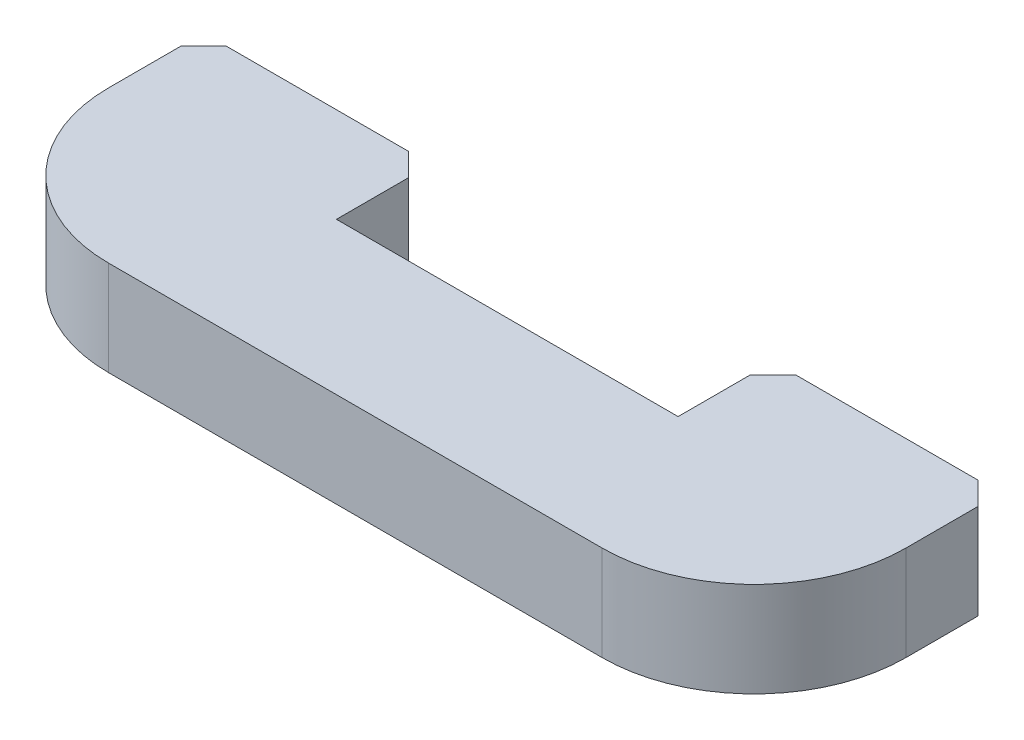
SolidWorks part; units mm, degrees
ref_plane "Front Plane" through (0, 0, 0) normal (0, 0, 1) x (1, 0, 0)
ref_plane "Top Plane" through (0, 0, 0) normal (0, 1, 0) x (1, 0, 0)
ref_plane "Right Plane" through (0, 0, 0) normal (1, 0, 0) x (0, 0, -1)
sketch "Sketch1" plane through (0, 0, 0) normal (0, 1, 0) x (1, 0, 0)
  line L1 (-13.335, 4.1275) -> (13.335, 4.1275)
  line L2 (-13.335, 4.1275) -> (-13.335, -4.1275)
  line L3 (-13.335, -4.1275) -> (13.335, -4.1275)
  line L4 (13.335, 4.1275) -> (13.335, -4.1275)
  line L5 (-13.335, 4.1275) -> (13.335, -4.1275) construction
  line L6 (-13.335, -4.1275) -> (13.335, 4.1275) construction
  point P0 (0, 0)
extrude "Boss-Extrude1" add sketch "Sketch1" along normal blind 3.175
sketch "Sketch2" plane through (0, 3.175, 0) normal (0, 1, 0) x (1, 0, 0)
  line L0 (13.335, 4.1275) -> (-13.335, 4.1275) construction
  line L1 (-5.715, 7.3025) -> (5.715, 7.3025)
  line L2 (-5.715, 7.3025) -> (-5.715, 0.9525)
  line L3 (-5.715, 0.9525) -> (5.715, 0.9525)
  line L4 (5.715, 7.3025) -> (5.715, 0.9525)
  line L5 (-5.715, 7.3025) -> (5.715, 0.9525) construction
  line L6 (-5.715, 0.9525) -> (5.715, 7.3025) construction
  point P0 (0, 4.1275)
extrude "Cut-Extrude1" cut sketch "Sketch2" against normal through all
chamfer "Chamfer1" distance 0.762 4 edges at (13.335, 1.5875, -4.1275) (5.715, 1.5875, -4.1275) (-13.335, 1.5875, -4.1275) (-5.715, 1.5875, -4.1275)
fillet "Fillet1" radius 5.08 2 edges at (13.335, 1.5875, 4.1275) (-13.335, 1.5875, 4.1275)
sketch "Sketch3" plane through (0, 3.175, 0) normal (0, 1, 0) x (1, 0, 0)
  line L24 (-8.255, -4.2291) -> (8.255, -4.2291)
  line L25 (13.4366, 0.9525) -> (13.4366, 3.4076)
  line L26 (13.4366, 3.4076) -> (12.6151, 4.2291)
  line L27 (12.6151, 4.2291) -> (6.4349, 4.2291)
  line L28 (6.4349, 4.2291) -> (5.6134, 3.4076)
  line L29 (5.6134, 3.4076) -> (5.6134, 1.0541)
  line L30 (5.6134, 1.0541) -> (-5.6134, 1.0541)
  line L31 (-5.6134, 1.0541) -> (-5.6134, 3.4076)
  line L32 (-5.6134, 3.4076) -> (-6.4349, 4.2291)
  line L33 (-6.4349, 4.2291) -> (-12.6151, 4.2291)
  line L34 (-12.6151, 4.2291) -> (-13.4366, 3.4076)
  line L35 (-13.4366, 3.4076) -> (-13.4366, 0.9525)
  line L36 (-8.255, -4.2291) -> (8.255, -4.2291)
  line L37 (13.4366, 0.9525) -> (13.4366, 3.4076)
  line L38 (13.4366, 3.4076) -> (12.6151, 4.2291)
  line L39 (12.6151, 4.2291) -> (6.4349, 4.2291)
  line L40 (6.4349, 4.2291) -> (5.6134, 3.4076)
  line L41 (5.6134, 3.4076) -> (5.6134, 1.0541)
  line L42 (5.6134, 1.0541) -> (-5.6134, 1.0541)
  line L43 (-5.6134, 1.0541) -> (-5.6134, 3.4076)
  line L44 (-5.6134, 3.4076) -> (-6.4349, 4.2291)
  line L45 (-6.4349, 4.2291) -> (-12.6151, 4.2291)
  line L46 (-12.6151, 4.2291) -> (-13.4366, 3.4076)
  line L47 (-13.4366, 3.4076) -> (-13.4366, 0.9525)
  arc A4 (8.255, -4.2291) -> (13.4366, 0.9525) centre (8.255, 0.9525) ccw
  arc A5 (-13.4366, 0.9525) -> (-8.255, -4.2291) centre (-8.255, 0.9525) ccw
  arc A6 (8.255, -4.2291) -> (13.4366, 0.9525) centre (8.255, 0.9525) ccw
  arc A7 (-13.4366, 0.9525) -> (-8.255, -4.2291) centre (-8.255, 0.9525) ccw
equation "\"D1@Sketch1\"=2*(.375+.300/2)"
equation "\"D2@Sketch1\"=.2 + \"t\""
equation "\"D1@Boss-Extrude1\"=\"t\""
equation "\"t\"= .125'plywood thickness"
equation "\"D1@Sketch2\"=2*(.375-.3/2)"
equation "\"D2@Sketch2\"=\"t\"*2"
equation "\"kerf\"= .004in'Kerf for laser cutter"
equation "\"D1@Sketch3\"=\"kerf\""
